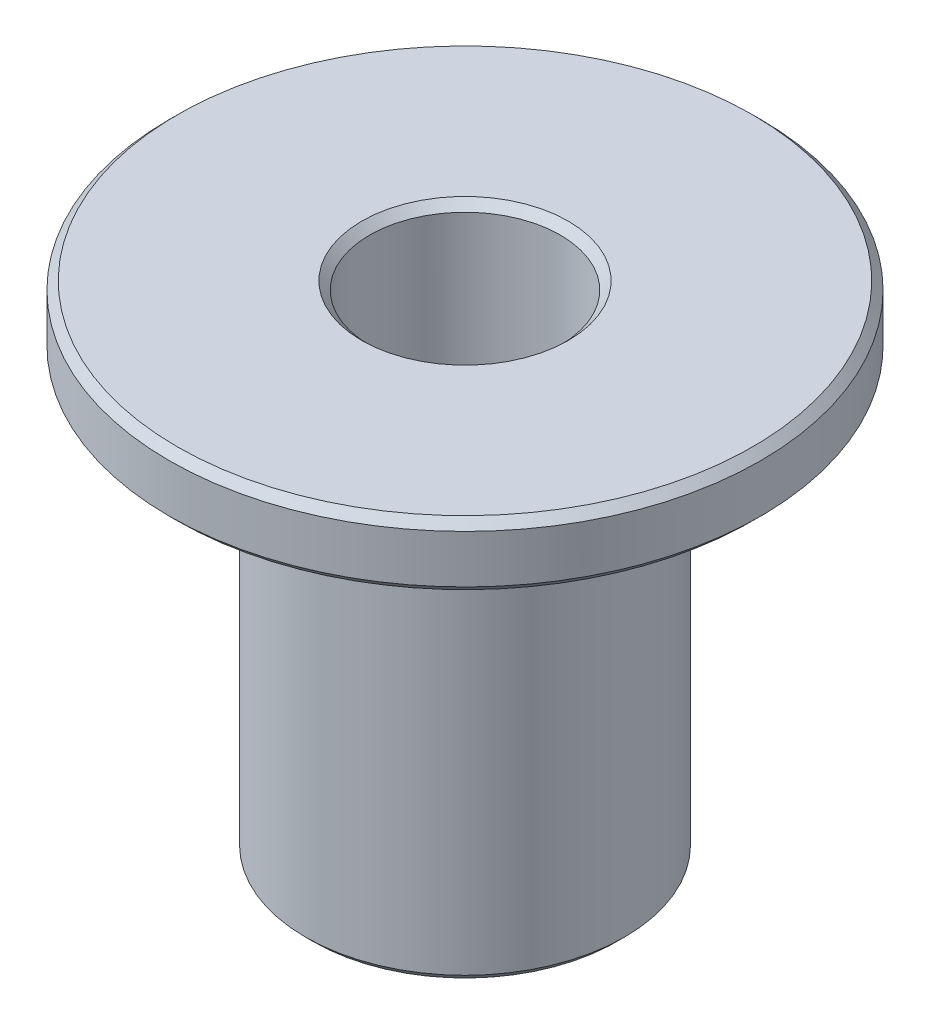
SolidWorks part; units mm, degrees
ref_plane "Plan1" through (0, 0, 0) normal (0, 0, 1) x (1, 0, 0)
ref_plane "Plan2" through (0, 0, 0) normal (0, 1, 0) x (1, 0, 0)
ref_plane "Plan3" through (0, 0, 0) normal (1, 0, 0) x (0, 0, -1)
sketch "Esquisse1" plane through (0, 0, 0) normal (0, 0, 1) x (1, 0, 0)
  line L0 (2.975, 14.5) -> (2.975, 30)
  line L1 (2.975, 30) -> (9.225, 30)
  line L2 (9.225, 30) -> (9.225, 28)
  line L3 (9.225, 28) -> (4.975, 28)
  line L4 (4.975, 28) -> (4.975, 14.5)
  line L5 (4.975, 14.5) -> (2.975, 14.5)
  line L6 (0, 30) -> (0, 10) construction
  dimension "D1" = 2
  dimension "D2" = 6.25
  dimension "D3" = 2.975
  dimension "D4" = 2
  dimension "D5" = 15.5
revolve "Base-Révolution" add sketch "Esquisse1" angle 360 about L6
chamfer "Chanfrein1" distance 0.25 angle 45
